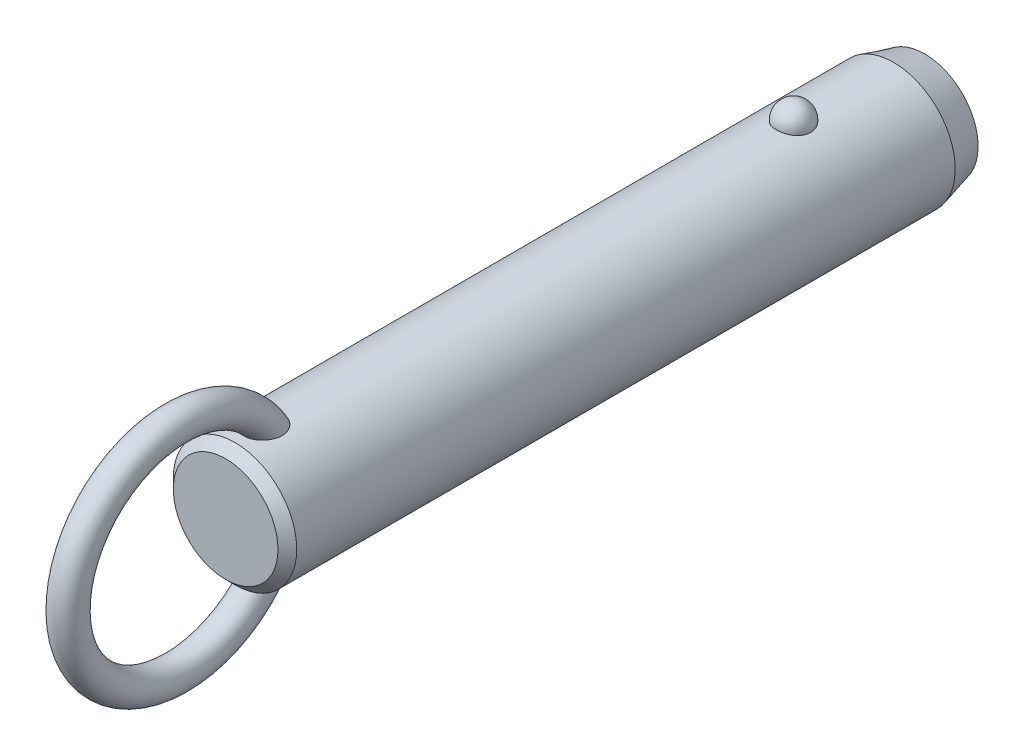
SolidWorks part; units mm, degrees
ref_plane "Front Plane" through (0, 0, 0) normal (0, 0, 1) x (1, 0, 0)
ref_plane "Top Plane" through (0, 0, 0) normal (0, 1, 0) x (1, 0, 0)
ref_plane "Right Plane" through (0, 0, 0) normal (1, 0, 0) x (0, 0, -1)
sketch "Sketch2" plane through (0, 0, 0) normal (0, 0, 1) x (1, 0, 0)
  circle A0 centre (0, 0) radius 7.9
  point P3 (0, 7.9)
  dimension "D1" = 15.8
extrude "Boss-Extrude1" add sketch "Sketch2" along normal blind 61
sketch "Sketch3" plane through (0, 0, 0) normal (0, 0, -1) x (-1, 0, 0)
  circle A0 centre (0, 0) radius 7.9
  dimension "D1" = 15.8
extrude "Boss-Extrude2" add sketch "Sketch3" along normal blind 19
chamfer "Chamfer1" distance 4 angle 15 1 edges at (-7.9, 0, -19)
sketch "Sketch12" plane through (0, 0, 0) normal (1, 0, 0) x (0, 0, -1)
  line L0 (-61, 7.9) -> (-61, -7.9) construction
  point P0 (-61, 0)
sketch "Sketch13" plane through (0, 0, 0) normal (1, 0, 0) x (0, 0, -1)
  circle A0 centre (-76.85, 0) radius 15.85
  point P2 (-61, 0)
  dimension "D1" = 31.7
sketch "Sketch14" plane through (0, 0, 0) normal (0, 1, 0) x (1, 0, 0)
  circle A0 centre (0, -63) radius 2
  point P2 (0, -61)
  dimension "D1" = 4
sweep "Sweep1" add profiles "Sketch14" path "Sketch13"
sketch "Sketch15" plane through (0, 0, 61) normal (0, 0, 1) x (1, 0, 0)
  circle A0 centre (0, 0) radius 7.9
  dimension "D1" = 15.8
extrude "Boss-Extrude3" add sketch "Sketch15" along normal blind 9.52
chamfer "Chamfer2" distance 1.2 angle 45 1 edges at (7.9, 0, 70.52)
sketch "Sketch18" plane through (0, 0, 0) normal (1, 0, 0) x (0, 0, -1)
  line L0 (15, 7.9) -> (-63.1091, 7.9) construction
  line L1 (2.2, 10.1) -> (2.2, 5.7)
  line L2 (-63.1091, -7.9) -> (15, -7.9) construction
  arc A0 (2.2, 10.1) -> (2.2, 5.7) centre (2.2, 7.9) ccw
  point P4 (0, 7.9)
  dimension "D1" = 18
revolve "Revolve1" add sketch "Sketch18" angle 360 about L1
